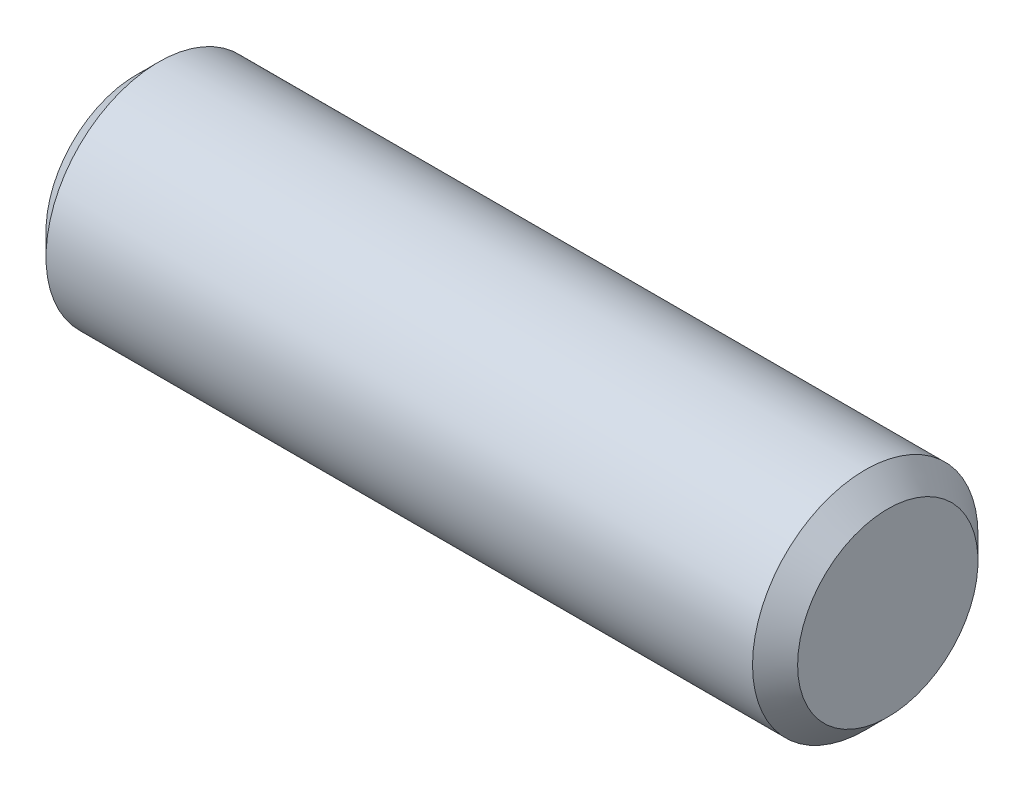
SolidWorks part; units mm, degrees
ref_plane "Front" through (0, 0, 0) normal (0, 0, 1) x (1, 0, 0)
ref_plane "Top" through (0, 0, 0) normal (0, 1, 0) x (1, 0, 0)
ref_plane "Right" through (0, 0, 0) normal (1, 0, 0) x (0, 0, -1)
sketch "Sketch1" plane through (0, 0, 0) normal (0, 0, 1) x (1, 0, 0)
  line L0 (-3.9688, 0) -> (3.9688, 0) construction
  line L1 (3.9688, 1.1906) -> (3.9688, -1.1906) construction
  line L2 (-3.9688, 1.1906) -> (-3.9688, -1.1906) construction
sketch "Sketch2" plane through (0, 0, 0) normal (1, 0, 0) x (0, 0, -1)
  circle A0 centre (0, 0) radius 1.1906
extrude "Extrude1" add sketch "Sketch2" against normal up to vertex (3.9688 mm away) and the other way up to vertex (3.9688 mm away)
chamfer "Chamfer1" distance 0.2381 angle 45 2 edges at (3.9688, 0, -1.1906) (-3.9688, 0, -1.1906)
equation "\"D1@Chamfer1\" = \"Diameter@Sketch1\"*.1"
